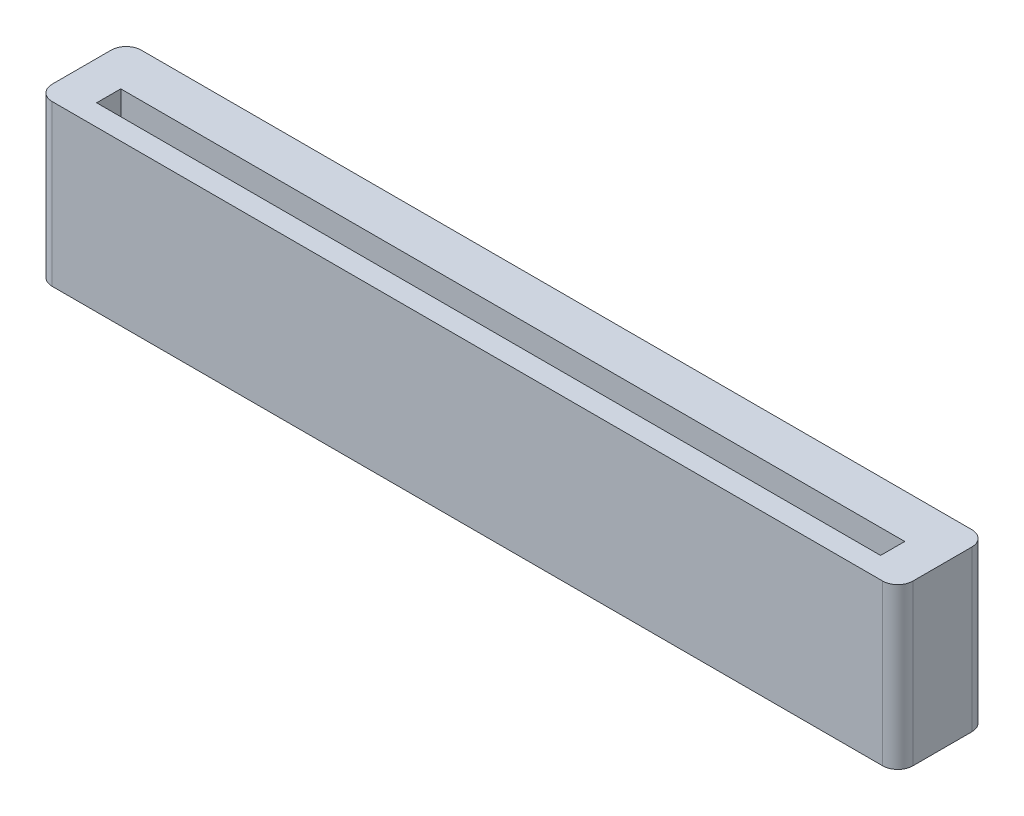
SolidWorks part; units mm, degrees
ref_plane "Plan de face" through (0, 0, 0) normal (0, 0, 1) x (1, 0, 0)
ref_plane "Plan de dessus" through (0, 0, 0) normal (0, 1, 0) x (1, 0, 0)
ref_plane "Plan de droite" through (0, 0, 0) normal (1, 0, 0) x (0, 0, -1)
sketch "Esquisse1" plane through (0, 0, 0) normal (0, 1, 0) x (1, 0, 0)
  line L1 (1, 0) -> (56, 0)
  line L2 (0, 1) -> (0, 4.9)
  line L3 (1, 5.9) -> (56, 5.9)
  line L4 (57, 1) -> (57, 4.9)
  arc A0 (1, 5.9) -> (0, 4.9) centre (1, 4.9) ccw
  arc A1 (57, 4.9) -> (56, 5.9) centre (56, 4.9) ccw
  arc A2 (57, 1) -> (56, 0) centre (56, 1) cw
  arc A3 (0, 1) -> (1, 0) centre (1, 1) ccw
  point P9 (57, 5.9)
  point P12 (57, 0)
  point P15 (0, 0)
  dimension "D3" = 1
  dimension "D1" = 57
  dimension "D2" = 5.9
extrude "Extrusion1" add sketch "Esquisse1" along normal blind 10.6
sketch "Esquisse2" plane through (0, 10.6, 0) normal (0, 1, 0) x (-1, 0, 0)
  line L0 (-1, 0) -> (-56, 0) construction
  line L1 (-2.54, -3) -> (-54.46, -3)
  line L2 (-2.54, -3) -> (-2.54, -1.4)
  line L3 (-2.54, -1.4) -> (-54.46, -1.4)
  line L4 (-54.46, -3) -> (-54.46, -1.4)
  line L5 (-56, -5.9) -> (-1, -5.9) construction
  line L6 (-57, -1) -> (-57, -4.9) construction
  line L7 (0, -4.9) -> (0, -1) construction
  dimension "D1" = 1.4
  dimension "D2" = 2.9
  dimension "D3" = 2.54
  dimension "D4" = 2.54
extrude "Enlèv. mat.-Extru.1" cut sketch "Esquisse2" against normal blind 6
